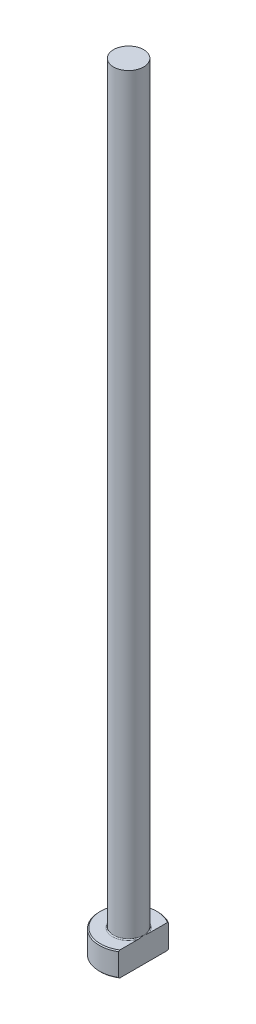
SolidWorks part; units mm, degrees
ref_plane "Front Plane" through (0, 0, 0) normal (0, 0, 1) x (1, 0, 0)
ref_plane "Top Plane" through (0, 0, 0) normal (0, 1, 0) x (1, 0, 0)
ref_plane "Right Plane" through (0, 0, 0) normal (1, 0, 0) x (0, 0, -1)
sketch "Sketch1" plane through (0, 0, 0) normal (0, 0, 1) x (1, 0, 0)
  line L0 (0, 259.9588) -> (0, -15.1925) construction
  line L1 (0, 0) -> (-6, 0)
  line L2 (-6, 0) -> (-6, 5)
  line L3 (-6, 5) -> (-3.1, 5)
  line L4 (-3.1, 5) -> (-3.1, 160)
  line L5 (-3.1, 160) -> (0, 160)
  line L6 (0, 160) -> (0, 0)
  dimension "L" = 160
  dimension "H" = 12
  dimension "T" = 5
  dimension "D" = 6.2
revolve "Revolve1" add sketch "Sketch1" angle 360 about L0
chamfer "Chamfer1" distance 0.2 angle 45 2 edges at (0, 5, 6) (0, 0, 6)
fillet "Fillet1" radius 0.2 1 edges at (0, 5, 3.1)
sketch "Sketch2" plane through (0, 0, 0) normal (0, 1, 0) x (1, 0, 0)
  line L0 (3.1, 5.1371) -> (3.1, -5.1371)
  circle A0 centre (0, 0) radius 6 construction
  arc A1 (3.1, -5.1371) -> (3.1, 5.1371) centre (0, 0) ccw
  circle A2 centre (0, 0) radius 3.1 construction
extrude "KEY" cut sketch "Sketch2" along normal through all
